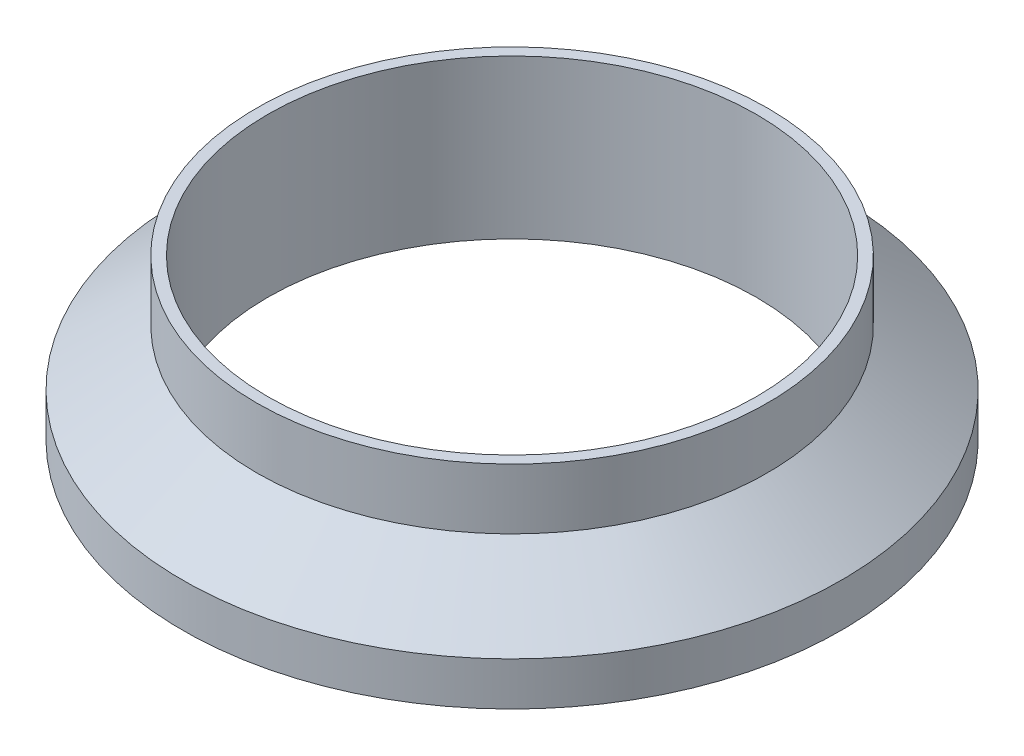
SolidWorks part; units mm, degrees
ref_plane "Front Plane" through (0, 0, 0) normal (0, 0, 1) x (1, 0, 0)
ref_plane "Top Plane" through (0, 0, 0) normal (0, 1, 0) x (1, 0, 0)
ref_plane "Right Plane" through (0, 0, 0) normal (1, 0, 0) x (0, 0, -1)
sketch "Sketch1" plane through (0, 0, 0) normal (0, 0, 1) x (1, 0, 0)
  line L0 (-36.449, 0.1966) -> (-36.449, 23.8252)
  line L1 (-36.449, 23.8252) -> (-38.1, 23.8252)
  line L2 (-38.1, 23.8252) -> (-38.1, 14.803)
  line L3 (-38.1, 14.803) -> (-49.149, 6.477)
  line L4 (-49.149, 6.477) -> (-49.149, 0)
  line L5 (-49.149, 0) -> (-45.156, 0)
  line L6 (-36.449, 0.1966) -> (-40.4823, 0.1966)
  line L7 (0, 0) -> (0, 37.9334) construction
  arc A0 (-40.4823, 0.1966) -> (-45.156, 0) centre (-42.799, -0.381) ccw
  dimension "D1" = 4.7752
  dimension "D2" = 36.449
  dimension "D3" = 38.1
  dimension "D4" = 42.799
  dimension "D5" = 49.149
  dimension "D6" = 6.477
  dimension "D7" = 23.8252
  dimension "D8" = 127
  dimension "D9" = 0.381
revolve "Revolve1" add sketch "Sketch1" angle 360 about L7
